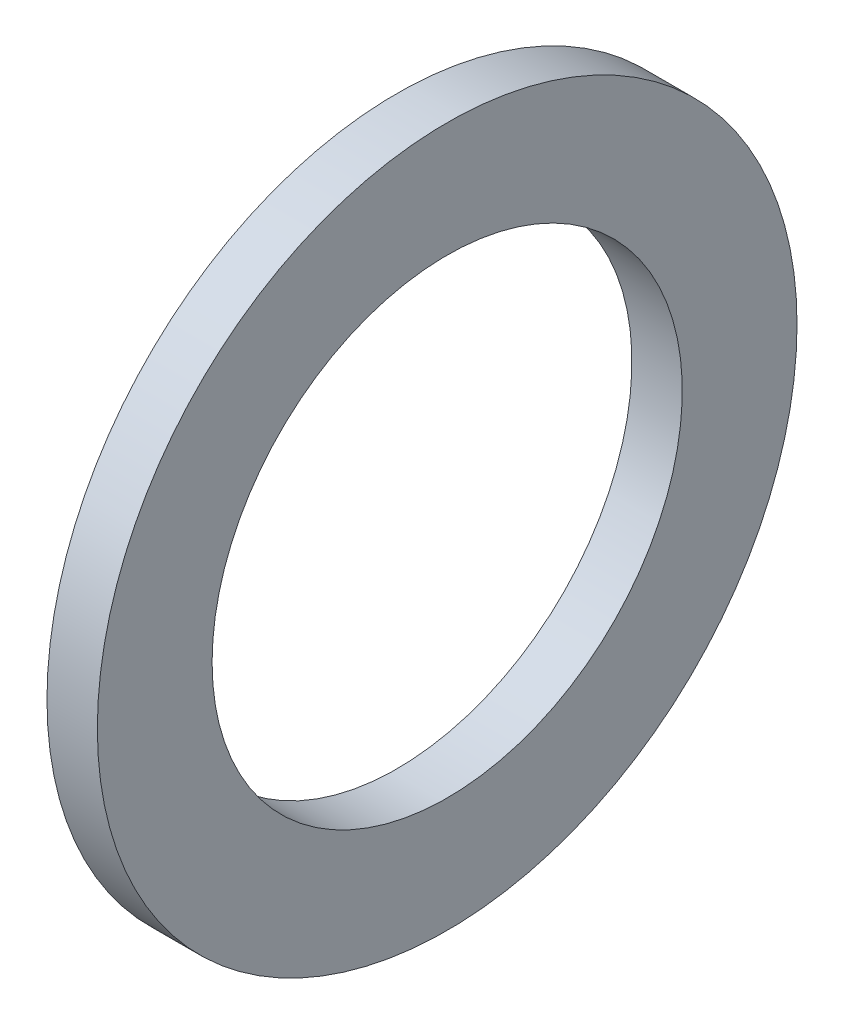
SolidWorks part; units mm, degrees
ref_plane "Plane1" through (0, 0, 0) normal (0, 0, 1) x (1, 0, 0)
ref_plane "Plane2" through (0, 0, 0) normal (0, 1, 0) x (1, 0, 0)
ref_plane "Plane3" through (0, 0, 0) normal (1, 0, 0) x (0, 0, -1)
other "Configuration Table"
sketch "Sketch1" plane through (0, 0, 0) normal (0, 0, 1) x (1, 0, 0)
  line L0 (-34.925, 0) -> (9.525, 0) construction
  line L1 (0, 84) -> (0, 125)
  line L2 (0, 125) -> (-18, 125)
  line L3 (-18, 125) -> (-18, 84)
  line L4 (-18, 84) -> (0, 84)
  dimension "Thickness" = 18
  dimension "Inside_dia" = 168
  dimension "Outside_dia" = 250
revolve "Base-Revolve" add sketch "Sketch1" angle 360 about L0
